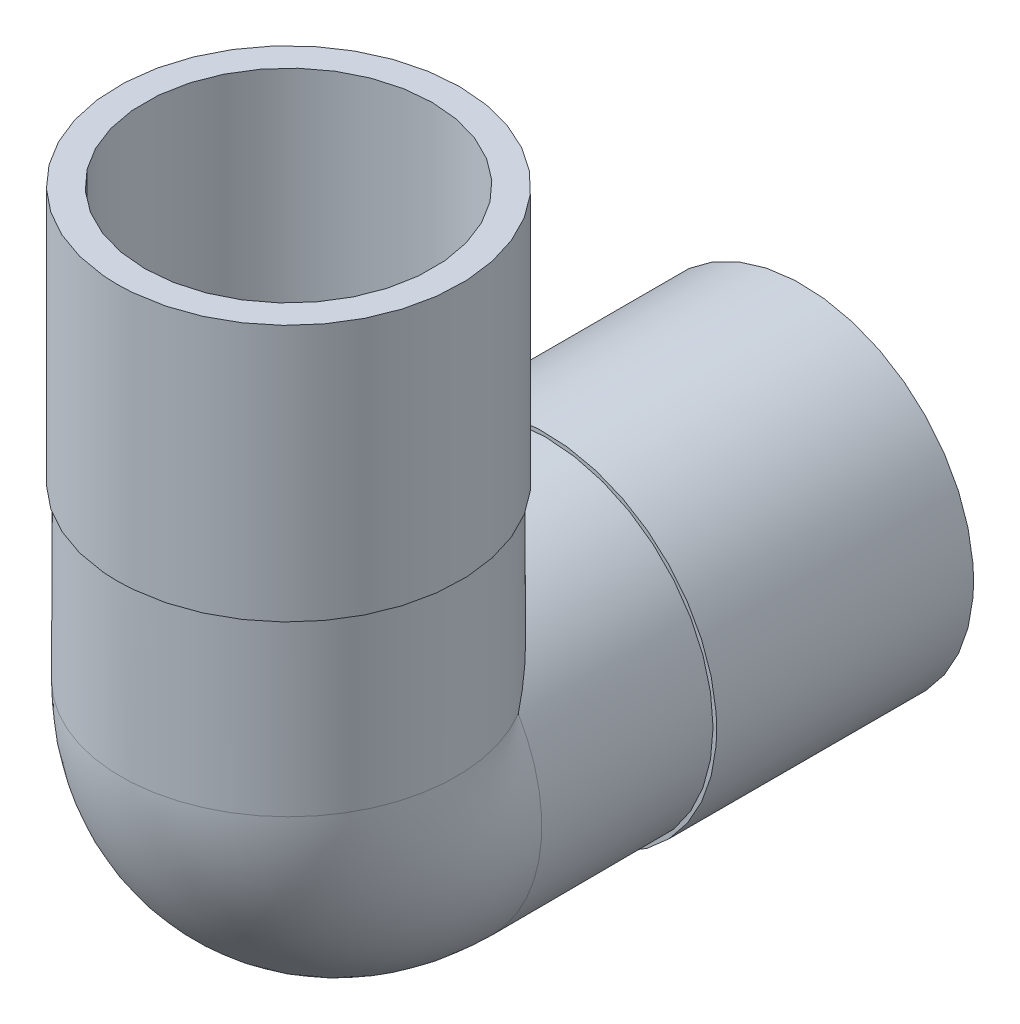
SolidWorks part; units mm, degrees
ref_plane "Front Plane" through (0, 0, 0) normal (0, 0, 1) x (1, 0, 0)
ref_plane "Top Plane" through (0, 0, 0) normal (0, 1, 0) x (1, 0, 0)
ref_plane "Right Plane" through (0, 0, 0) normal (1, 0, 0) x (0, 0, -1)
sketch "Sketch1" plane through (0, 0, 0) normal (0, 0, 1) x (1, 0, 0)
  circle A0 centre (0, 0) radius 10.668
  circle A1 centre (0, 0) radius 12.7
  dimension "D1" = 21.336
  dimension "D2" = 25.4
extrude "Boss-Extrude1" add sketch "Sketch1" along normal blind 19.05
sketch "Sketch2" plane through (0, 0, 19.05) normal (0, 0, 1) x (1, 0, 0)
  circle A0 centre (0, 0) radius 6.35
  dimension "D1" = 12.7
sketch "Sketch3" plane through (0, 0, 0) normal (1, 0, 0) x (0, 0, -1)
  line L0 (-19.05, 0) -> (-31.75, 0)
  line L2 (-38.1, 6.35) -> (-38.1, 19.05)
  line L3 (-19.05, 6.35) -> (-19.05, -6.35) construction
  arc A0 (-38.1, 6.35) -> (-31.75, 0) centre (-31.75, 6.35) ccw
  point P7 (0, 0)
  point P9 (0, 0)
  dimension "D2" = 6.35
  dimension "D1" = 12.7
  dimension "D3" = 6.35
  dimension "D4" = 12.7
sweep "Sweep-Thin2" add profiles "Sketch2" path "Sketch3" parameters "D1"=6.08
sketch "Sketch7" plane through (0, 19.05, 0) normal (0, 1, 0) x (1, 0, 0)
  circle A0 centre (0, -38.1) radius 10.668
  circle A1 centre (0, -38.1) radius 12.7
  dimension "D1" = 21.336
  dimension "D2" = 25.4
extrude "Boss-Extrude2" add sketch "Sketch7" along normal blind 19.05
